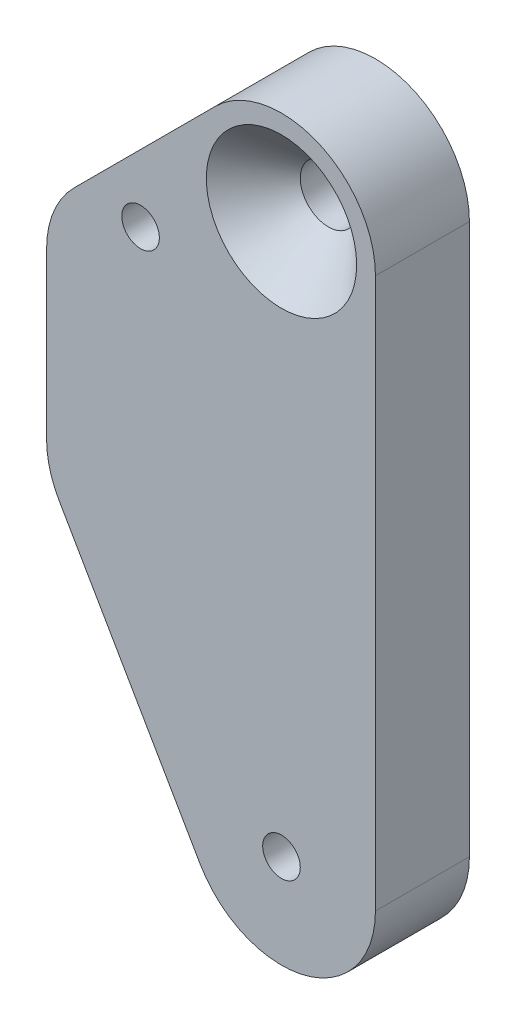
SolidWorks part; units mm, degrees
ref_plane "Plan de face" through (0, 0, 0) normal (0, 0, 1) x (1, 0, 0)
ref_plane "Plan de dessus" through (0, 0, 0) normal (0, 1, 0) x (1, 0, 0)
ref_plane "Plan de droite" through (0, 0, 0) normal (1, 0, 0) x (0, 0, -1)
sketch "Esquisse1" plane through (0, 0, 0) normal (0, 0, 1) x (1, 0, 0)
  line L0 (-15, 115) -> (-15, 56.4564)
  line L1 (-50, 100) -> (-50, 82.4372)
  line L2 (-47.0711, 107.0711) -> (-32.0711, 122.0711)
  line L4 (-48.6603, 77.4372) -> (-33.6603, 51.4564)
  line L5 (-50, 104.1421) -> (-31.5493, 104.1421) construction
  circle A0 centre (-25, 115) radius 3
  circle A1 centre (-40, 107) radius 2
  circle A2 centre (-25, 56.4564) radius 2
  arc A3 (-15, 115) -> (-32.0711, 122.0711) centre (-25, 115) ccw
  arc A4 (-33.6603, 51.4564) -> (-15, 56.4564) centre (-25, 56.4564) ccw
  arc A5 (-84.1233, 47.6518) -> (-60.3267, 78.4126) centre (-87.6054, 74.9305) ccw construction
  arc A6 (-50, 82.4372) -> (-48.6603, 77.4372) centre (-40, 82.4372) ccw
  arc A7 (-47.0711, 107.0711) -> (-50, 100) centre (-40, 100) ccw
  dimension "D3" = 6
  dimension "D4" = 4
  dimension "D5" = 4
  dimension "D7" = 8
  dimension "D9" = 20
  dimension "D12" = 10
  dimension "D1" = 35
  dimension "D2" = 10
  dimension "D6" = 25
  dimension "D8" = 58.5436
  dimension "D10" = 45
  dimension "D11" = 150
extrude "Boss.-Extru.1" add sketch "Esquisse1" along normal blind 10
chamfer "Chanfrein1" distance 5 angle 45 1 edges at (-22, 115, 10)
sketch "Esquisse2" plane through (-77.0711, 77.0711, 0) normal (-0.7071, 0.7071, 0) x (0, 0, 1)
  line L0 (0, 66.5949) -> (0, 75.4585) construction
  line L1 (10, 49.3762) -> (0, 49.3762) construction
  circle A0 centre (5, 47.3762) radius 2
  dimension "D3" = 4
  dimension "D1" = 5
  dimension "D2" = 2
extrude "Enlèv. mat.-Extru.1" cut sketch "Esquisse2" against normal up to next
